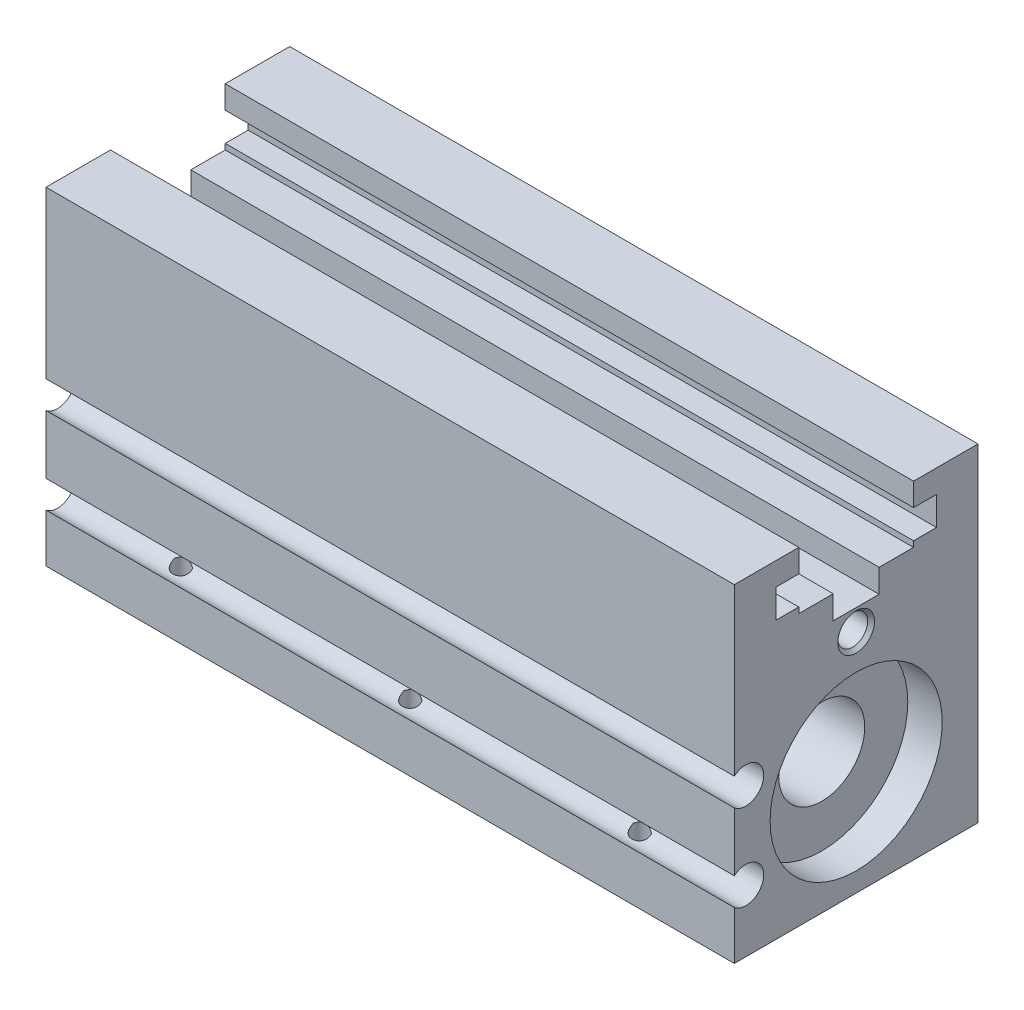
SolidWorks part; units mm, degrees
ref_plane "Front Plane" through (0, 0, 0) normal (0, 0, 1) x (1, 0, 0)
ref_plane "Top Plane" through (0, 0, 0) normal (0, 1, 0) x (1, 0, 0)
ref_plane "Right Plane" through (0, 0, 0) normal (1, 0, 0) x (0, 0, -1)
sketch "Sketch1" plane through (0, 0, 0) normal (1, 0, 0) x (0, 0, -1)
  line L0 (-13.4874, -18.161) -> (13.4874, -18.161)
  line L1 (13.4874, -18.161) -> (13.4874, 18.161)
  line L2 (13.4874, 18.161) -> (6.35, 18.161)
  line L3 (6.35, 18.161) -> (6.35, 15.621)
  line L4 (6.35, 15.621) -> (8.89, 15.621)
  line L5 (8.89, 15.621) -> (8.89, 12.446)
  line L6 (8.89, 12.446) -> (6.35, 12.446)
  line L7 (6.35, 12.446) -> (6.35, 11.811)
  line L8 (6.35, 11.811) -> (2.54, 11.811)
  line L9 (2.54, 11.811) -> (2.54, 9.2202)
  line L10 (2.54, 9.2202) -> (-2.54, 9.2202)
  line L11 (-2.54, 9.2202) -> (-2.54, 11.811)
  line L12 (-2.54, 11.811) -> (-6.35, 11.811)
  line L13 (-6.35, 11.811) -> (-6.35, 12.446)
  line L14 (-6.35, 12.446) -> (-8.89, 12.446)
  line L15 (-8.89, 12.446) -> (-8.89, 15.621)
  line L16 (-8.89, 15.621) -> (-6.35, 15.621)
  line L17 (-6.35, 15.621) -> (-6.35, 18.161)
  line L18 (-6.35, 18.161) -> (-13.4874, 18.161)
  line L19 (-13.4874, 18.161) -> (-13.4874, -0.2066)
  line L20 (-13.4874, -3.2478) -> (-13.4874, -9.757)
  line L21 (-13.4874, -12.7982) -> (-13.4874, -18.161)
  arc A0 (-13.4874, -0.2066) -> (-13.4874, -3.2478) centre (-12.2174, -1.7272) cw
  arc A1 (-13.4874, -9.757) -> (-13.4874, -12.7982) centre (-12.2174, -11.2776) cw
extrude "Extrude1" add sketch "Sketch1" along normal blind 76.2
ref_plane "Plane1" through (76.2, 0, 0) normal (1, 0, 0) x (0, 0, -1)
sketch "Sketch2" plane through (76.2, 0, 0) normal (1, 0, 0) x (0, 0, -1)
  circle A0 centre (0, -6.5024) radius 9.525
extrude "Cut-Extrude1" cut sketch "Sketch2" against normal blind 3.81
sketch "Sketch3" plane through (0, 0, 0) normal (1, 0, 0) x (0, 0, -1)
  circle A0 centre (10.3251, 8.4582) radius 1.2027
extrude "Cut-Extrude2" cut sketch "Sketch3" along normal blind 3.048
sketch "Sketch4" plane through (0, 0, 0) normal (1, 0, 0) x (0, 0, -1)
  circle A0 centre (-10.3251, -15.367) radius 1.2027
extrude "Cut-Extrude3" cut sketch "Sketch4" along normal blind 3.048
ref_plane "Plane2" through (0, 0, 10.3251) normal (0, 0, 1) x (1, 0, 0)
sketch "Sketch5" plane through (0, 0, 10.3251) normal (0, 0, 1) x (1, 0, 0)
  line L0 (0, 8.4582) -> (0, 9.8552)
  line L1 (0, 9.8552) -> (0.381, 9.4742)
  line L2 (0.381, 9.4742) -> (6.2714, 9.4742)
  line L3 (6.2714, 9.4742) -> (6.858, 8.4582)
  line L4 (6.858, 8.4582) -> (0, 8.4582)
  line L5 (6.858, 8.4582) -> (0, 8.4582) construction
revolve "Cut-Revolve1" cut sketch "Sketch5" angle 360 about L5
ref_plane "Plane3" through (0, 0, -10.3251) normal (0, 0, 1) x (1, 0, 0)
sketch "Sketch6" plane through (0, 0, -10.3251) normal (0, 0, 1) x (1, 0, 0)
  line L0 (0, -15.367) -> (0, -13.97)
  line L1 (0, -13.97) -> (0.381, -14.351)
  line L2 (0.381, -14.351) -> (6.2714, -14.351)
  line L3 (6.2714, -14.351) -> (6.858, -15.367)
  line L4 (6.858, -15.367) -> (0, -15.367)
  line L5 (6.858, -15.367) -> (0, -15.367) construction
revolve "Cut-Revolve2" cut sketch "Sketch6" angle 360 about L5
ref_plane "Plane4" through (5.715, 0, 0) normal (1, 0, 0) x (0, 0, -1)
sketch "Sketch7" plane through (5.715, 0, 0) normal (1, 0, 0) x (0, 0, -1)
  line L0 (8.9154, 3.8862) -> (8.9154, 5.8293)
  line L1 (8.9154, 5.8293) -> (13.0175, 5.8293)
  line L2 (13.0175, 5.8293) -> (13.4874, 6.2992)
  line L3 (13.4874, 6.2992) -> (13.4874, 3.8862)
  line L4 (13.4874, 3.8862) -> (8.9154, 3.8862)
  line L5 (13.4874, 3.8862) -> (8.9154, 3.8862) construction
revolve "Cut-Revolve3" cut sketch "Sketch7" angle 360 about L5
ref_plane "Plane5" through (67.31, 0, 0) normal (1, 0, 0) x (0, 0, -1)
sketch "Sketch8" plane through (67.31, 0, 0) normal (1, 0, 0) x (0, 0, -1)
  line L0 (8.9154, 3.8862) -> (8.9154, 5.8293)
  line L1 (8.9154, 5.8293) -> (13.0175, 5.8293)
  line L2 (13.0175, 5.8293) -> (13.4874, 6.2992)
  line L3 (13.4874, 6.2992) -> (13.4874, 3.8862)
  line L4 (13.4874, 3.8862) -> (8.9154, 3.8862)
  line L5 (13.4874, 3.8862) -> (8.9154, 3.8862) construction
revolve "Cut-Revolve4" cut sketch "Sketch8" angle 360 about L5
sketch "Sketch9" plane through (0, 0, 0) normal (1, 0, 0) x (0, 0, -1)
  circle A0 centre (0, -6.5024) radius 9.525
extrude "Cut-Extrude4" cut sketch "Sketch9" along normal blind 3.81
sketch "Sketch10" plane through (0, 0, 0) normal (0, 0, 1) x (1, 0, 0)
  line L0 (0, -6.5024) -> (0, 2.8321)
  line L1 (0, 2.8321) -> (3.81, 2.8321)
  line L2 (3.81, 2.8321) -> (3.81, -6.5024)
  line L3 (3.81, -6.5024) -> (0, -6.5024)
  line L4 (3.81, -6.5024) -> (0, -6.5024) construction
revolve "Revolve1" add sketch "Sketch10" angle 360 about L4
ref_plane "Plane6" through (12.7, 0, 0) normal (1, 0, 0) x (0, 0, -1)
sketch "Sketch11" plane through (12.7, 0, 0) normal (1, 0, 0) x (0, 0, -1)
  line L0 (-11.1125, -18.161) -> (-12.5095, -18.161)
  line L1 (-12.5095, -18.161) -> (-12.1285, -17.78)
  line L2 (-12.1285, -17.78) -> (-12.1285, -12.804)
  line L3 (-12.1285, -12.804) -> (-11.1125, -12.2174)
  line L4 (-11.1125, -12.2174) -> (-11.1125, -18.161)
  line L5 (-11.1125, -12.2174) -> (-11.1125, -18.161) construction
revolve "Cut-Revolve5" cut sketch "Sketch11" angle 360 about L5
ref_plane "Plane7" through (0, -18.161, 0) normal (0, 1, 0) x (-1, 0, 0)
ref_plane "Plane8" through (63.5, 0, 0) normal (1, 0, 0) x (0, 0, -1)
ref_plane "Plane9" through (63.5, 0, 0) normal (1, 0, 0) x (0, 0, -1)
ref_plane "Plane10" through (12.7, 0, 0) normal (1, 0, 0) x (0, 0, -1)
sketch "Sketch12" plane through (63.5, 0, 0) normal (1, 0, 0) x (0, 0, -1)
  line L0 (-11.1125, -18.161) -> (-12.5095, -18.161)
  line L1 (-12.5095, -18.161) -> (-12.1285, -17.78)
  line L2 (-12.1285, -17.78) -> (-12.1285, -12.804)
  line L3 (-12.1285, -12.804) -> (-11.1125, -12.2174)
  line L4 (-11.1125, -12.2174) -> (-11.1125, -18.161)
  line L5 (-11.1125, -12.2174) -> (-11.1125, -18.161) construction
sketch "Sketch13" plane through (63.5, 0, 0) normal (1, 0, 0) x (0, 0, -1)
  line L0 (11.1125, -18.161) -> (9.7155, -18.161)
  line L1 (9.7155, -18.161) -> (10.0965, -17.78)
  line L2 (10.0965, -17.78) -> (10.0965, -12.804)
  line L3 (10.0965, -12.804) -> (11.1125, -12.2174)
  line L4 (11.1125, -12.2174) -> (11.1125, -18.161)
  line L5 (11.1125, -12.2174) -> (11.1125, -18.161) construction
sketch "Sketch14" plane through (12.7, 0, 0) normal (1, 0, 0) x (0, 0, -1)
  line L0 (11.1125, -18.161) -> (9.7155, -18.161)
  line L1 (9.7155, -18.161) -> (10.0965, -17.78)
  line L2 (10.0965, -17.78) -> (10.0965, -12.804)
  line L3 (10.0965, -12.804) -> (11.1125, -12.2174)
  line L4 (11.1125, -12.2174) -> (11.1125, -18.161)
  line L5 (11.1125, -12.2174) -> (11.1125, -18.161) construction
revolve "Cut-Revolve6" cut sketch "Sketch12" angle 360 about L5
revolve "Cut-Revolve7" cut sketch "Sketch13" angle 360 about L5
revolve "Cut-Revolve8" cut sketch "Sketch14" angle 360 about L5
sketch "Sketch15" plane through (0, -18.161, 0) normal (0, 1, 0) x (-1, 0, 0)
  circle A0 centre (-19.05, 11.1125) radius 1.2027
extrude "Cut-Extrude5" cut sketch "Sketch15" along normal blind 3.175
sketch "Sketch16" plane through (0, -18.161, 0) normal (0, 1, 0) x (-1, 0, 0)
  circle A0 centre (-57.15, 11.1125) radius 1.2027
sketch "Sketch17" plane through (0, -18.161, 0) normal (0, 1, 0) x (-1, 0, 0)
  circle A0 centre (-57.15, -11.1125) radius 1.2027
sketch "Sketch18" plane through (0, -18.161, 0) normal (0, 1, 0) x (-1, 0, 0)
  circle A0 centre (-19.05, -11.1125) radius 1.2027
extrude "Cut-Extrude6" cut sketch "Sketch16" along normal blind 3.175
extrude "Cut-Extrude7" cut sketch "Sketch17" along normal blind 3.175
extrude "Cut-Extrude8" cut sketch "Sketch18" along normal blind 3.175
sketch "Sketch19" plane through (0, 0, 0) normal (0, 0, 1) x (1, 0, 0)
  line L0 (0, 5.3609) -> (0, 7.3929)
  line L1 (0, 7.3929) -> (0.381, 7.0119)
  line L2 (0.381, 7.0119) -> (3.048, 7.0119)
  line L3 (3.048, 7.0119) -> (3.048, 5.3609)
  line L4 (3.048, 5.3609) -> (0, 5.3609)
  line L5 (3.048, 5.3609) -> (0, 5.3609) construction
revolve "Cut-Revolve9" cut sketch "Sketch19" angle 360 about L5
sketch "Sketch20" plane through (0, 0, 0) normal (0, 0, 1) x (1, 0, 0)
  line L0 (11.43, -6.5024) -> (11.43, -1.7399)
  line L1 (11.43, -1.7399) -> (72.39, -1.7399)
  line L2 (72.39, -1.7399) -> (72.39, -6.5024)
  line L3 (72.39, -6.5024) -> (11.43, -6.5024)
  line L4 (72.39, -6.5024) -> (11.43, -6.5024) construction
revolve "Cut-Revolve10" cut sketch "Sketch20" angle 360 about L4
sketch "Sketch21" plane through (0, 0, 0) normal (0, 0, 1) x (1, 0, 0)
  line L0 (73.152, 6.8834) -> (73.152, 8.5344)
  line L1 (73.152, 8.5344) -> (75.819, 8.5344)
  line L2 (75.819, 8.5344) -> (76.2, 8.9154)
  line L3 (76.2, 8.9154) -> (76.2, 6.8834)
  line L4 (76.2, 6.8834) -> (73.152, 6.8834)
  line L5 (76.2, 6.8834) -> (73.152, 6.8834) construction
revolve "Cut-Revolve11" cut sketch "Sketch21" angle 360 about L5
ref_plane "Plane11" through (76.2025, 0, 0) normal (1, 0, 0) x (0, 0, -1)
ref_plane "Plane12" through (38.1, 0, 0) normal (1, 0, 0) x (0, 0, -1)
sketch "Sketch22" plane through (38.1, 0, 0) normal (1, 0, 0) x (0, 0, -1)
  line L0 (-11.1125, -18.161) -> (-12.5095, -18.161)
  line L1 (-12.5095, -18.161) -> (-12.1285, -17.78)
  line L2 (-12.1285, -17.78) -> (-12.1285, -12.804)
  line L3 (-12.1285, -12.804) -> (-11.1125, -12.2174)
  line L4 (-11.1125, -12.2174) -> (-11.1125, -18.161)
  line L5 (-11.1125, -12.2174) -> (-11.1125, -18.161) construction
revolve "Cut-Revolve12" cut sketch "Sketch22" angle 360 about L5
sketch "Sketch23" plane through (38.1, 0, 0) normal (1, 0, 0) x (0, 0, -1)
  line L0 (11.1125, -18.161) -> (9.7155, -18.161)
  line L1 (9.7155, -18.161) -> (10.0965, -17.78)
  line L2 (10.0965, -17.78) -> (10.0965, -12.804)
  line L3 (10.0965, -12.804) -> (11.1125, -12.2174)
  line L4 (11.1125, -12.2174) -> (11.1125, -18.161)
  line L5 (11.1125, -12.2174) -> (11.1125, -18.161) construction
revolve "Cut-Revolve13" cut sketch "Sketch23" angle 360 about L5
ref_plane "Plane13" through (76.2, 0, 0) normal (1, 0, 0) x (0, 0, -1)
ref_plane "Plane14" through (25.5016, 0, 0) normal (1, 0, 0) x (0, 0, -1)
